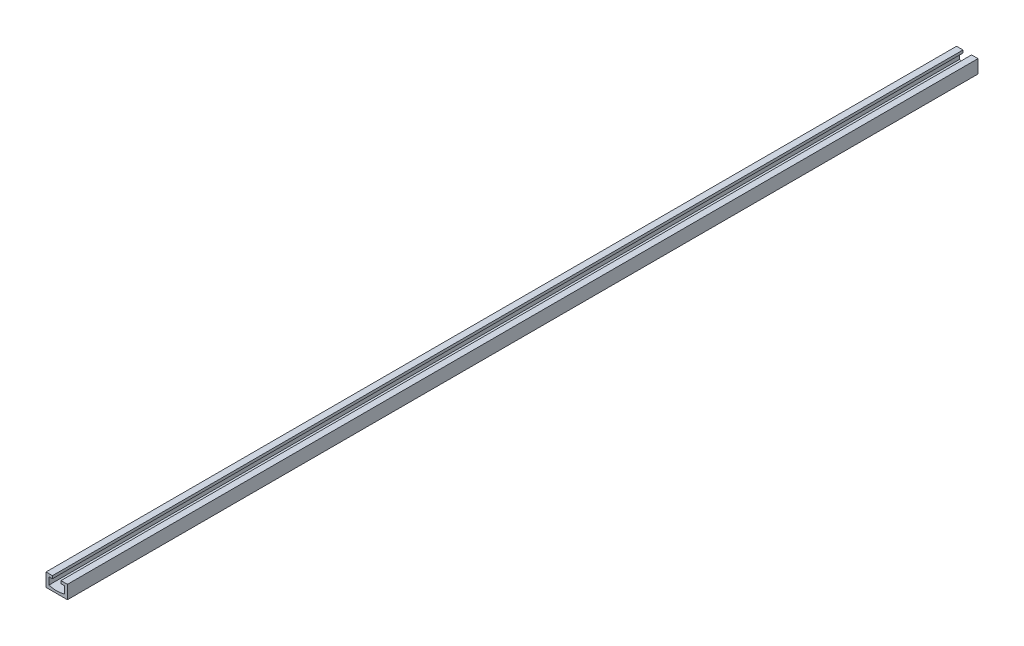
SolidWorks part; units mm, degrees
ref_plane "前视基准面" through (0, 0, 0) normal (0, 0, 1) x (1, 0, 0)
ref_plane "上视基准面" through (0, 0, 0) normal (0, 1, 0) x (1, 0, 0)
ref_plane "右视基准面" through (0, 0, 0) normal (1, 0, 0) x (0, 0, -1)
sketch "草图1" plane through (0, 0, 0) normal (0, 0, 1) x (1, 0, 0)
  line L1 (-4, -2.5) -> (4, -2.5)
  line L2 (-4, -2.5) -> (-4, 2.5)
  line L3 (-4, 2.5) -> (4, 2.5)
  line L4 (4, -2.5) -> (4, 2.5)
  line L5 (-4, -2.5) -> (4, 2.5) construction
  line L6 (-4, 2.5) -> (4, -2.5) construction
  point P0 (0, 0)
  dimension "D1" = 8
  dimension "D2" = 5
extrude "凸台-拉伸1" add sketch "草图1" along normal mid plane 340
sketch "草图2" plane through (0, 0, 170) normal (0, 0, 1) x (1, 0, 0)
  line L0 (0, 2.5) -> (0, -3.7958) construction
  line L1 (4, 2.5) -> (-4, 2.5) construction
  line L2 (-1.6, 2.5) -> (1.6, 2.5)
  line L3 (1.6, 2.5) -> (1.6, 1.5)
  line L4 (1.6, 1.5) -> (2.9, 1.5)
  line L5 (2.9, 1.5) -> (2.9, -1.2)
  line L6 (-2.9, 1.5) -> (-2.9, -1.2)
  line L7 (-1.6, 1.5) -> (-2.9, 1.5)
  line L8 (-1.6, 2.5) -> (-1.6, 1.5)
  arc A0 (-2.9, -1.2) -> (2.9, -1.2) centre (0, 8.3703) ccw
  dimension "D5" = 10
  dimension "D1" = 3.2
  dimension "D2" = 5.8
  dimension "D3" = 1
  dimension "D4" = 2.7
extrude "切除-拉伸1" cut sketch "草图2" against normal through all
sketch "草图3" plane through (0, -2.5, 0) normal (0, -1, 0) x (1, 0, 0)
  line L0 (0, 170) -> (0, 100) construction
  line L1 (-4, 170) -> (4, 170) construction
  line L2 (0, -170) -> (0, -100) construction
  line L3 (-2.9, -170) -> (2.9, -170) construction
  circle A0 centre (0, 100) radius 1.5
  circle A1 centre (0, -100) radius 1.5
  dimension "D1" = 3
  dimension "D3" = 70
  dimension "D2" = 70
extrude "切除-拉伸2" cut sketch "草图3" against normal through all
chamfer "倒角1" distance 0.5 angle 45 2 edges at (-0.3261, -1.6244, 101.4641) (-0.3261, -1.6244, -98.5359)
